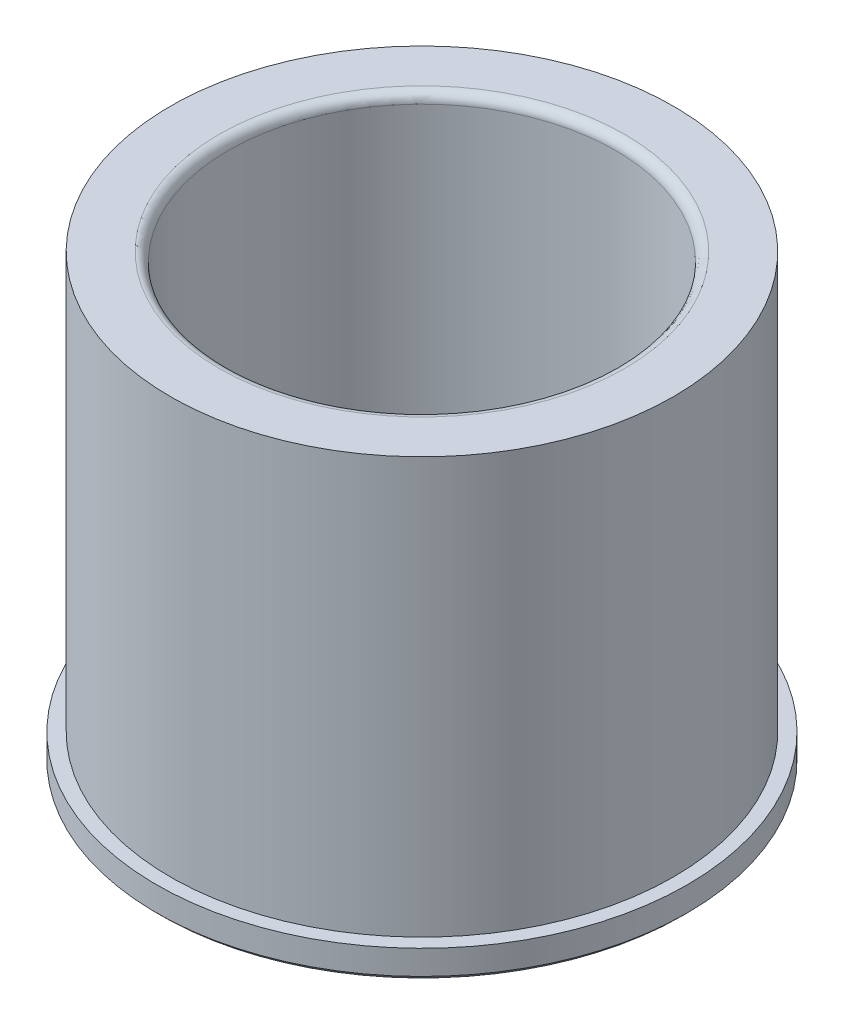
SolidWorks part; units mm, degrees
ref_plane "Front Plane" through (0, 0, 0) normal (0, 0, 1) x (1, 0, 0)
ref_plane "Top Plane" through (0, 0, 0) normal (0, 1, 0) x (1, 0, 0)
ref_plane "Right Plane" through (0, 0, 0) normal (1, 0, 0) x (0, 0, -1)
sketch "Sketch1" plane through (0, 0, 0) normal (0, 0, 1) x (1, 0, 0)
  line L0 (-42.7609, 0) -> (-43.5229, 0.762)
  line L1 (0, -1000) -> (0, 49000) construction
  line L2 (-31.7564, 73.025) -> (-31.7563, 0.762)
  line L3 (-32.5183, 0) -> (-42.7609, 0)
  line L4 (-43.5229, 0.762) -> (-43.5229, 4.7625)
  line L5 (-43.5229, 4.7625) -> (-41.2813, 4.7625)
  line L6 (-41.2814, 73.025) -> (-41.2813, 4.7625)
  line L7 (-41.2814, 73.025) -> (-31.7564, 73.025)
  line L8 (-32.5183, 0) -> (-31.7563, 0.762)
  dimension "OD" = 82.5627
  dimension "ID" = 63.5127
  dimension "H" = 87.0458
  dimension "D2" = 45
  dimension "OVERALL LENGTH" = 73.025
  dimension "D4" = 0.762
  dimension "D5" = 135
  dimension "T" = 4.7625
revolve "Revolve1" add sketch "Sketch1" angle 360 about L1
fillet "Fillet1" radius 1.524 1 edges at (31.7563, 73.025, 0)
